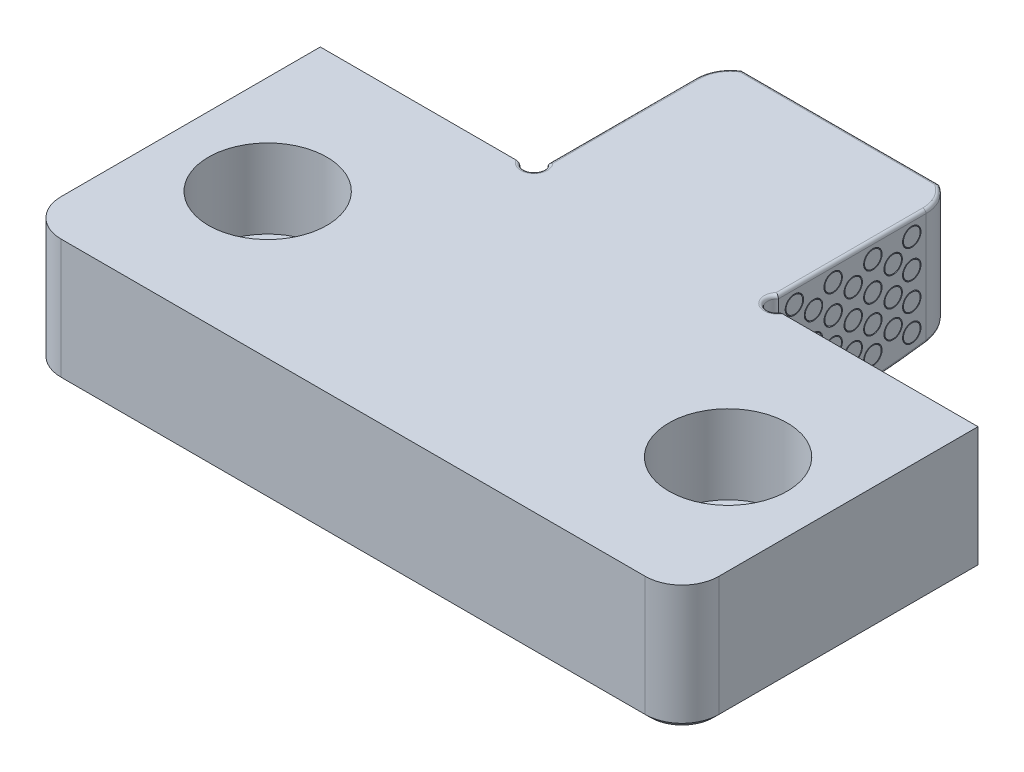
SolidWorks part; units mm, degrees
ref_plane "Front Plane" through (0, 0, 0) normal (0, 0, 1) x (1, 0, 0)
ref_plane "Top Plane" through (0, 0, 0) normal (0, 1, 0) x (1, 0, 0)
ref_plane "Right Plane" through (0, 0, 0) normal (1, 0, 0) x (0, 0, -1)
sketch "Sketch1" plane through (0, 0, 0) normal (0, 1, 0) x (1, 0, 0)
  line L0 (-50, -45) -> (50, -45)
  line L6 (-17.497, 0) -> (-17.497, 29.1)
  line L7 (-17.497, 29.1) -> (17.497, 29.1)
  line L8 (17.497, 29.1) -> (17.497, 0)
  line L9 (17.497, 0) -> (50, 0)
  line L10 (50, 0) -> (50, -45)
  line L12 (0, 0) -> (0, 50000) construction
  line L13 (0, 0) -> (-50000, 0) construction
  line L21 (-50, 0) -> (-50, -45)
  line L22 (-17.497, 0) -> (-50, 0)
  dimension "D1" = 34.994
  dimension "D2" = 45
  dimension "D3" = 74.1
  dimension "D4" = 100
extrude "Boss-Extrude1" add sketch "Sketch1" against normal blind 19 separate body
sketch "Sketch2" plane through (0, 0, 0) normal (0, 1, 0) x (1, 0, 0)
  line L0 (0, 0) -> (50000, 0) construction
  line L1 (0, 0) -> (0, 50000) construction
  line L4 (-17.497, 29.1) -> (-17.497, 0) construction
  line L5 (17.497, 29.1) -> (-17.497, 29.1) construction
  line L12 (17.497, 19.1) -> (17.497, 24.6)
  line L13 (17.497, 19.1) -> (25.4, 19.1)
  line L14 (25.4, 19.1) -> (25.4, 44.5)
  line L15 (-25.4, 44.5) -> (25.4, 44.5)
  line L16 (-25.4, 19.1) -> (-25.4, 44.5)
  line L17 (-17.497, 19.1) -> (-25.4, 19.1)
  line L18 (-17.497, 19.1) -> (-17.497, 24.6)
  line L19 (-14.9778, 29.1) -> (14.9778, 29.1)
  arc A0 (17.497, 24.6) -> (17.2054, 27.3058) centre (4.797, 24.6) ccw construction
  arc A1 (17.2054, 27.3058) -> (14.9778, 29.1) centre (14.9778, 26.82) ccw construction
  arc A2 (17.497, 24.6) -> (14.9778, 29.1) centre (12.2183, 24.6) ccw
  arc A6 (-17.2054, 27.3058) -> (-14.9778, 29.1) centre (-14.9778, 26.82) cw construction
  arc A7 (-17.497, 24.6) -> (-17.2054, 27.3058) centre (-4.797, 24.6) cw construction
  arc A8 (-17.497, 24.6) -> (-14.9778, 29.1) centre (-12.2183, 24.6) cw
  dimension "D1" = 10
  dimension "D3" = 50.8
  dimension "D4" = 2.28
  dimension "D5" = 12.7
  dimension "D6" = 4.5
  dimension "D2" = 25.4
extrude "Cut-Extrude1" cut sketch "Sketch2" against normal through all
sketch "Sketch3" plane through (0, 0, 0) normal (0, 1, 0) x (1, 0, 0)
  line L0 (0, 0) -> (0, 50000) construction
  line L1 (0, 0) -> (50000, 0) construction
  line L6 (50, -0.51) -> (17.497, -0.51)
  line L7 (50, -0.51) -> (17.497, -0.51) construction
  line L9 (16.987, 0) -> (16.987, 24.6)
  line L10 (16.987, 0) -> (16.987, 24.6) construction
  circle A0 centre (18.507, 1.01) radius 1.52
  circle A1 centre (-18.507, 1.01) radius 1.52
  dimension "D1" = 1.52
  dimension "D2" = 0.51
  dimension "D3" = 0.51
extrude "Cut-Extrude2" cut sketch "Sketch3" against normal through all
sketch "Sketch5" plane through (50, 0, 0) normal (1, 0, 0) x (0, 0, -1)
  line L0 (-63.088, -18.746) -> (49936.912, -18.746) construction
  line L1 (-45, -19) -> (0, -19) construction
  line L2 (29.1, -19) -> (29.1, 0) construction
  line L3 (0, 9.7237) -> (0, -49990.2763) construction
  line L4 (0, -19) -> (0, 0) construction
  line L5 (-22.5, 0) -> (-22.5, 50000) construction
  line L6 (-45, 0) -> (0, 0) construction
  line L7 (0, -18.746) -> (0, -61.0237)
  line L8 (0, -18.746) -> (8.7, -18.746)
  line L9 (50, -11.0237) -> (50, -61.0237)
  line L10 (50, -61.0237) -> (0, -61.0237)
  arc A0 (8.7, -18.746) -> (50, -11.0237) centre (8.7, 95.554) ccw
  point P16 (-22.5, 0)
  dimension "D2" = 114.3
  dimension "D3" = 20.4
  dimension "D1" = 0.254
  dimension "D4" = 50
  dimension "D5" = 50
extrude "Cut-Extrude3" cut sketch "Sketch5" against normal through all
fillet "Fillet1" radius 5.6 2 edges at (-50, -9.5, 45) (50, -9.5, 45)
fillet "Fillet2" radius 0.5 20 edges at (-16.3162, -17.1172, -27.9275) (17.1934, -17.3728, -26.3644) (17.497, 0, -13.373) (-16.8243, 0, -27.1786) (0, -16.9108, -29.1) (-17.497, -18.4678, -16.6694) (17.497, -18.4678, -16.6694) (16.8243, 0, -27.1786) (0, 0, -29.1) (-17.497, 0, -13.373) (18.507, -19, 0.51) (17.3711, -18.873, 0) (-17.3711, -18.873, 0) (-18.507, -19, 0.51) (-17.4322, 0, 0.0648) (17.4322, 0, 0.0648) (16.9896, -18.746, -1.099) (-16.9896, -18.746, -1.099) (-17.497, -18.746, -5.423) (17.497, -18.746, -5.423)
chamfer "Chamfer1" distance 0.8 angle 45 5 edges at (-50, -19, 19.7) (-48.3598, -19, 43.3598) (0, -19, 45) (48.3598, -19, 43.3598) (50, -19, 19.7)
hole_wizard "CBORE for M10 SHCS1" positions "Sketch10" profile "Sketch9" counterbore size "M10" standard "Ansi Metric"
sketch "Sketch10" plane through (0, 0, 0) normal (0, 1, 0) x (-1, 0, 0)
  line L0 (0, 0) -> (0, 50000) construction
  line L1 (44.4, 45) -> (-44.4, 45) construction
  line L2 (-50, 39.4) -> (-50, 0) construction
  point P0 (-35, 23)
  point P6 (0, 45)
  point P9 (35, 23)
  dimension "D1" = 15
  dimension "D2" = 22
sketch "Sketch9" plane through (35, 0, 23) normal (1, 0, 0) x (0, 0, 1)
  line L0 (0, 0) -> (0, 19.0485)
  line L1 (0, 19.0485) -> (5.5, 19.0485)
  line L3 (5.5, 19.0485) -> (5.5, 12)
  line L4 (5.5, 12) -> (9, 12)
  line L5 (9, 12) -> (9, 0)
  line L7 (9, 0) -> (0, 0)
  line L11 (0, -6.35) -> (0, 107.95) construction
  dimension "Thru Hole Dia." = 11
  dimension "Thru Hole Depth" = 19.0485
  dimension "C'Bore Dia." = 18
  dimension "C'Bore Depth" = 12
sketch "Sketch8" plane through (17.497, 0, 0) normal (1, 0, 0) x (0, 0, -1)
  circle A0 centre (22.4337, -2.4687) radius 1.4
  circle A1 centre (22.4337, -2.4687) radius 1.27
  circle A2 centre (22.4337, -15.1003) radius 1.4
  circle A3 centre (22.4337, -15.1003) radius 1.27
  circle A4 centre (22.4337, -6.8432) radius 1.4
  circle A5 centre (22.4337, -6.8432) radius 1.27
  circle A6 centre (22.4337, -11.0365) radius 1.4
  circle A7 centre (22.4337, -11.0365) radius 1.27
  circle A8 centre (19.6011, -4.644) radius 1.4
  circle A9 centre (19.6011, -4.644) radius 1.27
  circle A12 centre (19.6011, -9.0185) radius 1.4
  circle A13 centre (19.6011, -9.0185) radius 1.27
  circle A14 centre (19.6011, -13.2118) radius 1.4
  circle A15 centre (19.6011, -13.2118) radius 1.27
  circle A16 centre (16.5146, -2.4687) radius 1.4
  circle A17 centre (16.5146, -2.4687) radius 1.27
  circle A18 centre (16.5146, -15.1003) radius 1.4
  circle A19 centre (16.5146, -15.1003) radius 1.27
  circle A20 centre (16.5146, -6.8432) radius 1.4
  circle A21 centre (16.5146, -6.8432) radius 1.27
  circle A22 centre (16.5146, -11.0365) radius 1.4
  circle A23 centre (16.5146, -11.0365) radius 1.27
  circle A24 centre (13.5322, -4.644) radius 1.4
  circle A25 centre (13.5322, -4.644) radius 1.27
  circle A28 centre (13.5322, -9.0185) radius 1.4
  circle A29 centre (13.5322, -9.0185) radius 1.27
  circle A30 centre (13.5322, -13.2118) radius 1.4
  circle A31 centre (13.5322, -13.2118) radius 1.27
  circle A32 centre (10.4804, -2.4687) radius 1.4
  circle A33 centre (10.4804, -2.4687) radius 1.27
  circle A34 centre (10.4804, -15.9495) radius 1.4
  circle A35 centre (10.4804, -15.9495) radius 1.27
  circle A36 centre (10.4804, -6.8432) radius 1.4
  circle A37 centre (10.4804, -6.8432) radius 1.27
  circle A38 centre (10.4804, -11.0365) radius 1.4
  circle A39 centre (10.4804, -11.0365) radius 1.27
  circle A40 centre (7.498, -4.644) radius 1.4
  circle A41 centre (7.498, -4.644) radius 1.27
  circle A44 centre (7.498, -9.0185) radius 1.4
  circle A45 centre (7.498, -9.0185) radius 1.27
  circle A46 centre (7.498, -13.2118) radius 1.4
  circle A47 centre (7.498, -13.2118) radius 1.27
  circle A48 centre (4.5849, -2.4687) radius 1.4
  circle A49 centre (4.5849, -2.4687) radius 1.27
  circle A50 centre (4.5849, -15.7414) radius 1.4
  circle A51 centre (4.5849, -15.7414) radius 1.27
  circle A52 centre (4.5849, -6.8432) radius 1.4
  circle A53 centre (4.5849, -6.8432) radius 1.27
  circle A54 centre (4.5849, -11.0365) radius 1.4
  circle A55 centre (4.5849, -11.0365) radius 1.27
extrude "Cut-Extrude4" cut sketch "Sketch8" against normal blind 0.254
mirror "Mirror1" about plane through (0, 0, 0) normal (1, 0, 0) of "Cut-Extrude4"
